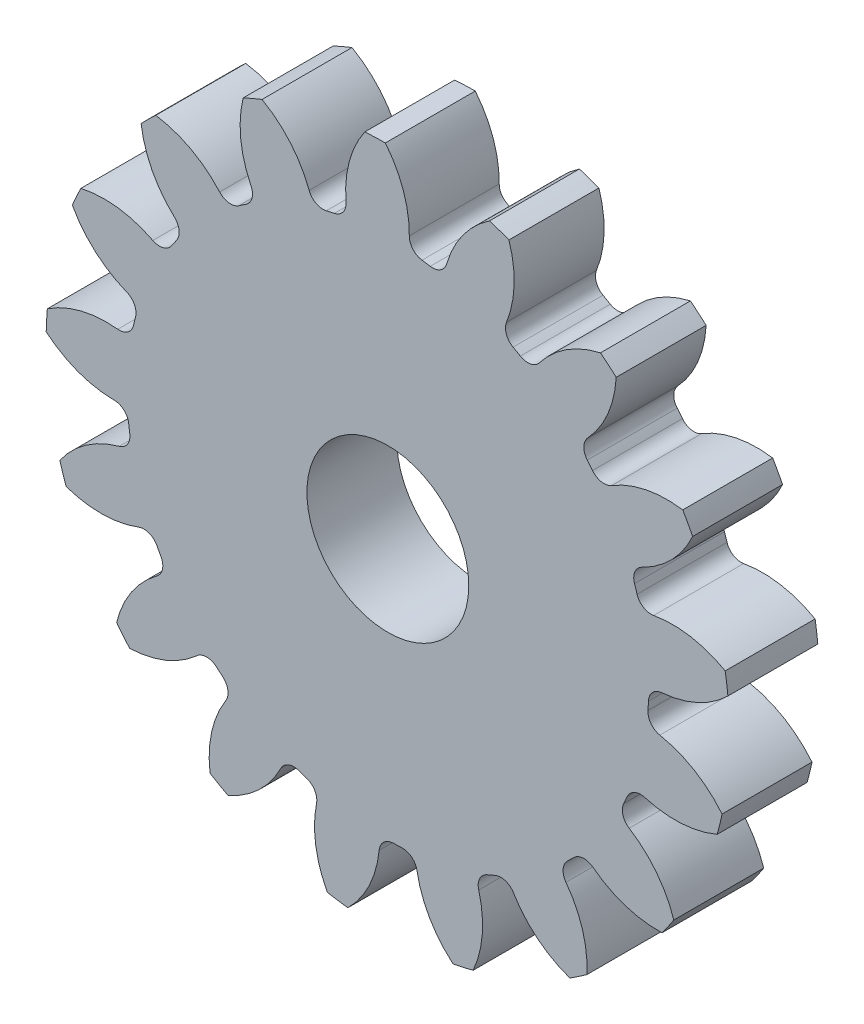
SolidWorks part; units mm, degrees
ref_plane "Front" through (0, 0, 0) normal (0, 0, 1) x (1, 0, 0)
ref_plane "Top" through (0, 0, 0) normal (0, 1, 0) x (1, 0, 0)
ref_plane "Right" through (0, 0, 0) normal (1, 0, 0) x (0, 0, -1)
sketch "Sketch3" plane through (0, 0, 0) normal (0, 0, 1) x (1, 0, 0)
  circle A0 centre (0, 0) radius 482.6
  dimension "od" = 965.2
extrude "gearBody" add sketch "Sketch3" along normal blind 127
sketch "Sketch2" plane through (0, 0, 0) normal (0, 0, 1) x (1, 0, 0)
  line L0 (0, 0) -> (374.8727, 155.2774) construction
  line L1 (474.1487, -103.0817) -> (0, 0) construction
  line L2 (0, 0) -> (36.3143, 0) construction
  line L3 (431.5034, 16.0022) -> (427.1376, -63.2825) construction
  line L5 (429.3205, -23.6401) -> (0, 0) construction
  line L7 (0, 0) -> (405.7593, 0) construction
  arc A0 (405.678, 8.1188) -> (402.334, -52.6113) centre (0, 0) ccw construction
  arc A1 (480.2074, 47.9964) -> (472.0344, -100.4307) centre (0, 0) ccw construction
  arc A2 (431.5034, 16.0022) -> (427.1376, -63.2825) centre (0, 0) ccw construction
  arc A3 (367.3731, -26.1127) -> (368.0191, -14.381) centre (0, 0) ccw
  arc A4 (474.1487, -103.0817) -> (384.075, -47.8789) centre (355.5576, -195.4978) ccw
  arc A5 (474.1487, -103.0817) -> (482.6, 50.3992) centre (0, 0) ccw
  arc A6 (482.6, 50.3992) -> (387.0099, 5.4198) centre (374.8727, 155.2774) cw
  arc A7 (368.0191, -14.381) -> (387.0099, 5.4198) centre (388.679, -15.1883) cw
  arc A8 (384.075, -47.8789) -> (367.3731, -26.1127) centre (387.9967, -27.5786) cw
  point P6 (482.6, 50.3992)
  point P22 (474.1487, -103.0817)
  dimension "baseDia" = 811.5185
  dimension "od" = 965.2
  dimension "pd" = 863.6
  dimension "rd" = 736.6
  dimension "rFillet" = 20.6756
  dimension "pointX" = 482.6
  dimension "pointY" = 50.3992
  dimension "CTT" = 79.2847
  dimension "flankCenterAngle" = 22.5
extrude "toothCut" cut sketch "Sketch2" along normal through all
pattern_circular "CirPattern1" count 17 over 360 about axis through (0, 0, 0) along (0, 0, 1) of "toothCut"
sketch "hub1Dia" plane through (0, 0, 0) normal (0, 0, -1) x (-1, 0, 0)
  circle A0 centre (0, 0) radius 12.7
  dimension "hub1Dia" = 25.4
sketch "hub2Dia" plane through (0, 0, 127) normal (0, 0, 1) x (1, 0, 0)
  circle A0 centre (0, 0) radius 12.7
  dimension "hub2dia" = 25.4
sketch "boreDia" plane through (0, 0, 0) normal (0, 0, 1) x (1, 0, 0)
  circle A0 centre (0, 0) radius 114.3
  dimension "boreDia" = 228.6
extrude "bore" cut sketch "boreDia" against normal mid plane 25400
